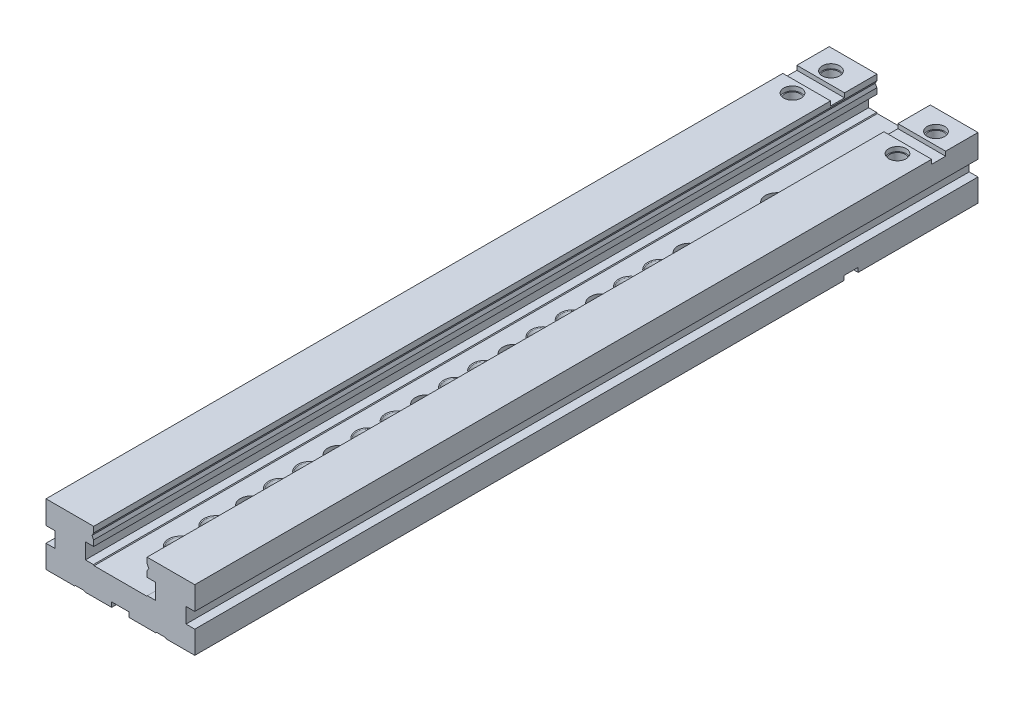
SolidWorks part; units mm, degrees
ref_plane "Front Plane" through (0, 0, 0) normal (0, 0, 1) x (1, 0, 0)
ref_plane "Top Plane" through (0, 0, 0) normal (0, 1, 0) x (1, 0, 0)
ref_plane "Right Plane" through (0, 0, 0) normal (1, 0, 0) x (0, 0, -1)
imported_body "Imported1"
sketch "Sketch1" plane through (0, -3.8, 0) normal (0, 1, 0) x (1, 0, 0)
  circle A0 centre (0, 150) radius 13
  circle A1 centre (0, 250) radius 13
  circle A2 centre (0, 350) radius 13
  circle A3 centre (0, 450) radius 13
  circle A4 centre (0, 550) radius 13
  circle A5 centre (0, 650) radius 13
  circle A6 centre (0, 750) radius 13
extrude "Boss-Extrude1" add sketch "Sketch1" against normal up to surface (25.7 mm away)
hole_wizard "Hole1" positions "Sketch3" profile "Sketch2" legacy
sketch "Sketch3" plane through (0, -3.8, 0) normal (0, 1, 0) x (1, 0, 0)
  line L0 (-30, 895) -> (30, 895) construction
  point P0 (0, 750)
  point P2 (0, 150)
  point P4 (0, 350)
  point P6 (0, 550)
  point P9 (0, 895)
  dimension "D1" = 145
  dimension "D2" = 200
  dimension "D3" = 200
  dimension "D4" = 200
sketch "Sketch2" plane through (0, -3.8, -750) normal (1, 0, 0) x (0, 0, 1)
  line L0 (0, 0) -> (0, 100)
  line L1 (0, 100) -> (8, 100)
  line L2 (8, 100) -> (8, 11)
  line L3 (8, 11) -> (13, 11)
  line L4 (13, 11) -> (13, 0)
  line L5 (13, 0) -> (0, 0)
  line L6 (0, 110) -> (0, -10) construction
  dimension "Diameter" = 16
  dimension "Depth" = 100
  dimension "C-Bore Diameter" = 26
  dimension "C-Bore Depth" = 11
hole_wizard "Hole2" positions "Sketch5" profile "Sketch4" legacy
sketch "Sketch5" plane through (0, -3.8, 0) normal (0, 1, 0) x (1, 0, 0)
  circle A0 centre (0, 750) radius 13 construction
  point P0 (0, 650)
  point P2 (0, 450)
  point P4 (0, 250)
  dimension "D1" = 100
  dimension "D2" = 200
  dimension "D3" = 200
sketch "Sketch4" plane through (0, -3.8, -650) normal (1, 0, 0) x (0, 0, 1)
  line L0 (0, 0) -> (0, 100)
  line L1 (0, 100) -> (6.5, 100)
  line L2 (6.5, 100) -> (6.5, 12.5)
  line L3 (6.5, 12.5) -> (9.5, 12.5)
  line L4 (9.5, 12.5) -> (9.5, 0)
  line L5 (9.5, 0) -> (0, 0)
  line L6 (0, 110) -> (0, -10) construction
  dimension "Diameter" = 13
  dimension "Depth" = 100
  dimension "C-Bore Diameter" = 19
  dimension "C-Bore Depth" = 12.5
sketch "Sketch6" plane through (0, -3.8, 0) normal (0, 1, 0) x (1, 0, 0)
  circle A0 centre (0, 150) radius 13
  circle A1 centre (0, 350) radius 13
  circle A2 centre (0, 550) radius 13
  circle A3 centre (0, 750) radius 13
  circle A4 centre (0, 250) radius 9.5
  circle A5 centre (0, 450) radius 9.5
  circle A6 centre (0, 650) radius 9.5543
extrude "Boss-Extrude2" add sketch "Sketch6" against normal up to surface (25.7 mm away)
hole_wizard "Hole3" positions "Sketch8" profile "Sketch7" legacy
sketch "Sketch8" plane through (0, -3.8, 0) normal (0, 1, 0) x (1, 0, 0)
  line L1 (-30, 895) -> (30, 895) construction
  circle A1 centre (0, 616.6667) radius 14 construction
  point P4 (0, 450)
  point P10 (0, 650)
  dimension "D1" = 245
  dimension "D2" = 0
  dimension "D4" = 200
sketch "Sketch7" plane through (0, -3.8, -450) normal (1, 0, 0) x (0, 0, 1)
  line L0 (0, 0) -> (0, 100)
  line L1 (0, 100) -> (8, 100)
  line L2 (8, 100) -> (8, 11)
  line L3 (8, 11) -> (13, 11)
  line L4 (13, 11) -> (13, 0)
  line L5 (13, 0) -> (0, 0)
  line L6 (0, 110) -> (0, -10) construction
  dimension "Diameter" = 16
  dimension "Depth" = 100
  dimension "C-Bore Diameter" = 26
  dimension "C-Bore Depth" = 11
hole_wizard "Hole4" positions "Sketch10" profile "Sketch9" legacy
sketch "Sketch10" plane through (0, -3.8, 0) normal (0, 1, 0) x (1, 0, 0)
  circle A0 centre (0, 650) radius 13 construction
  point P0 (0, 750)
  point P2 (0, 550)
  point P4 (0, 350)
  point P21 (0, 250)
  point P23 (0, 150)
  dimension "D1" = 100
  dimension "D2" = 200
  dimension "D3" = 200
  dimension "D4" = 100
  dimension "D5" = 100
sketch "Sketch9" plane through (0, -3.8, -750) normal (1, 0, 0) x (0, 0, 1)
  line L0 (0, 0) -> (0, 100)
  line L1 (0, 100) -> (8.5, 100)
  line L2 (8.5, 100) -> (8.5, 17)
  line L3 (8.5, 17) -> (13, 17)
  line L4 (13, 17) -> (13, 0)
  line L5 (13, 0) -> (0, 0)
  line L6 (0, 110) -> (0, -10) construction
  dimension "Diameter" = 17
  dimension "Depth" = 100
  dimension "C-Bore Diameter" = 26
  dimension "C-Bore Depth" = 17
